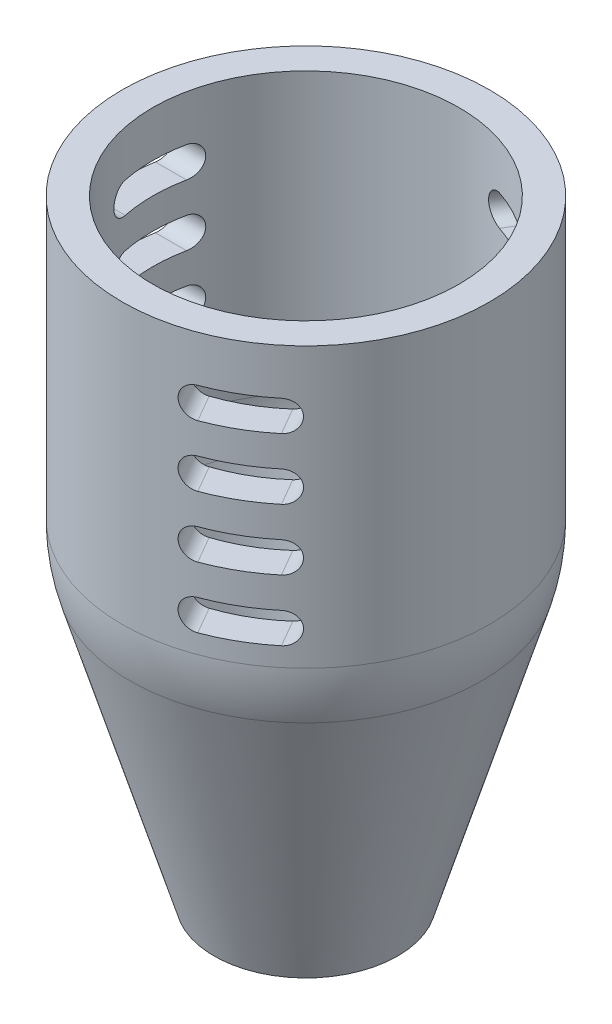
SolidWorks part; units mm, degrees
ref_plane "Alzado" through (0, 0, 0) normal (0, 0, 1) x (1, 0, 0)
ref_plane "Planta" through (0, 0, 0) normal (0, 1, 0) x (1, 0, 0)
ref_plane "Vista lateral" through (0, 0, 0) normal (1, 0, 0) x (0, 0, -1)
sketch "Croquis2" plane through (0, 0, 0) normal (0, 0, 1) x (1, 0, 0)
  line L0 (0, 0) -> (15, 0)
  line L1 (15, 0) -> (28.7348, 45.7826)
  line L2 (30, 54.4031) -> (30, 100)
  line L3 (30, 100) -> (0, 100)
  line L4 (0, 100) -> (0, 0)
  arc A0 (28.7348, 45.7826) -> (30, 54.4031) centre (0, 54.4031) ccw
  point P9 (30, 50)
  dimension "D5" = 30
  dimension "D1" = 15
  dimension "D2" = 50
  dimension "D3" = 100
  dimension "D4" = 30
revolve "Revolución3" add sketch "Croquis2" angle 360 about L4
shell "Vaciado2" thickness 10
sketch "Croquis3" plane through (0, 0, 0) normal (1, 0, 0) x (0, 0, -1)
  line L0 (-5, 60) -> (5, 60) construction
  line L1 (-5, 62.5) -> (5, 62.5)
  line L2 (-5, 57.5) -> (5, 57.5)
  line L3 (-15, 0) -> (15, 0) construction
  line L4 (-5, 70) -> (5, 70) construction
  line L5 (-5, 72.5) -> (5, 72.5)
  line L6 (-5, 67.5) -> (5, 67.5)
  line L7 (-5, 80) -> (5, 80) construction
  line L8 (-5, 82.5) -> (5, 82.5)
  line L9 (-5, 77.5) -> (5, 77.5)
  line L10 (-5, 90) -> (5, 90) construction
  line L11 (-5, 92.5) -> (5, 92.5)
  line L12 (-5, 87.5) -> (5, 87.5)
  arc A0 (-5, 62.5) -> (-5, 57.5) centre (-5, 60) ccw
  arc A1 (5, 57.5) -> (5, 62.5) centre (5, 60) ccw
  arc A2 (-5, 72.5) -> (-5, 67.5) centre (-5, 70) ccw
  arc A3 (5, 67.5) -> (5, 72.5) centre (5, 70) ccw
  arc A4 (-5, 82.5) -> (-5, 77.5) centre (-5, 80) ccw
  arc A5 (5, 77.5) -> (5, 82.5) centre (5, 80) ccw
  arc A6 (-5, 92.5) -> (-5, 87.5) centre (-5, 90) ccw
  arc A7 (5, 87.5) -> (5, 92.5) centre (5, 90) ccw
  point P2 (0, 60)
  point P15 (0, 70)
  point P23 (0, 80)
  point P30 (0, 90)
  dimension "D1" = 10
  dimension "D2" = 60
  dimension "D3" = 5
  dimension "D4" = 5
  dimension "D5" = 5
  dimension "D6" = 5
  dimension "D7" = 5
  dimension "D8" = 5
  dimension "D9" = 5
extrude "Cortar-Extruir2" cut sketch "Croquis3" against normal blind 61
pattern_circular "MatrizC1" count 3 every 120 about axis through (0, 100, 0) along (0, 1, 0) of "Cortar-Extruir2"
